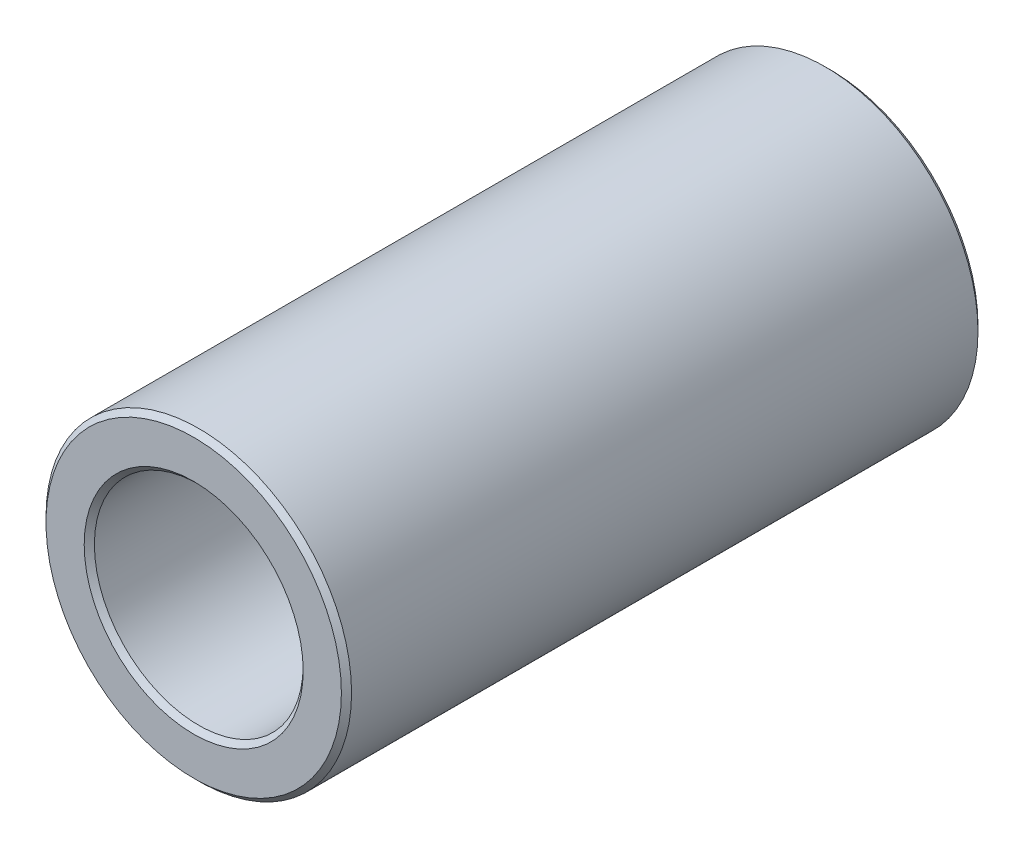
SolidWorks part; units mm, degrees
ref_plane "Front Plane" through (0, 0, 0) normal (0, 0, 1) x (1, 0, 0)
ref_plane "Top Plane" through (0, 0, 0) normal (0, 1, 0) x (1, 0, 0)
ref_plane "Right Plane" through (0, 0, 0) normal (1, 0, 0) x (0, 0, -1)
sketch "Sketch1" plane through (0, 0, 0) normal (0, 0, 1) x (1, 0, 0)
  circle A0 centre (0, 0) radius 6
  circle A1 centre (0, 0) radius 4.1
  dimension "D1" = 12
  dimension "D2" = 8.2
extrude "Boss-Extrude2" add sketch "Sketch1" along normal mid plane 25
chamfer "Chamfer3" distance 0.2 angle 45 4 edges at (6, 0, 12.5) (6, 0, -12.5) (4.1, 0, -12.5) (4.1, 0, 12.5)
